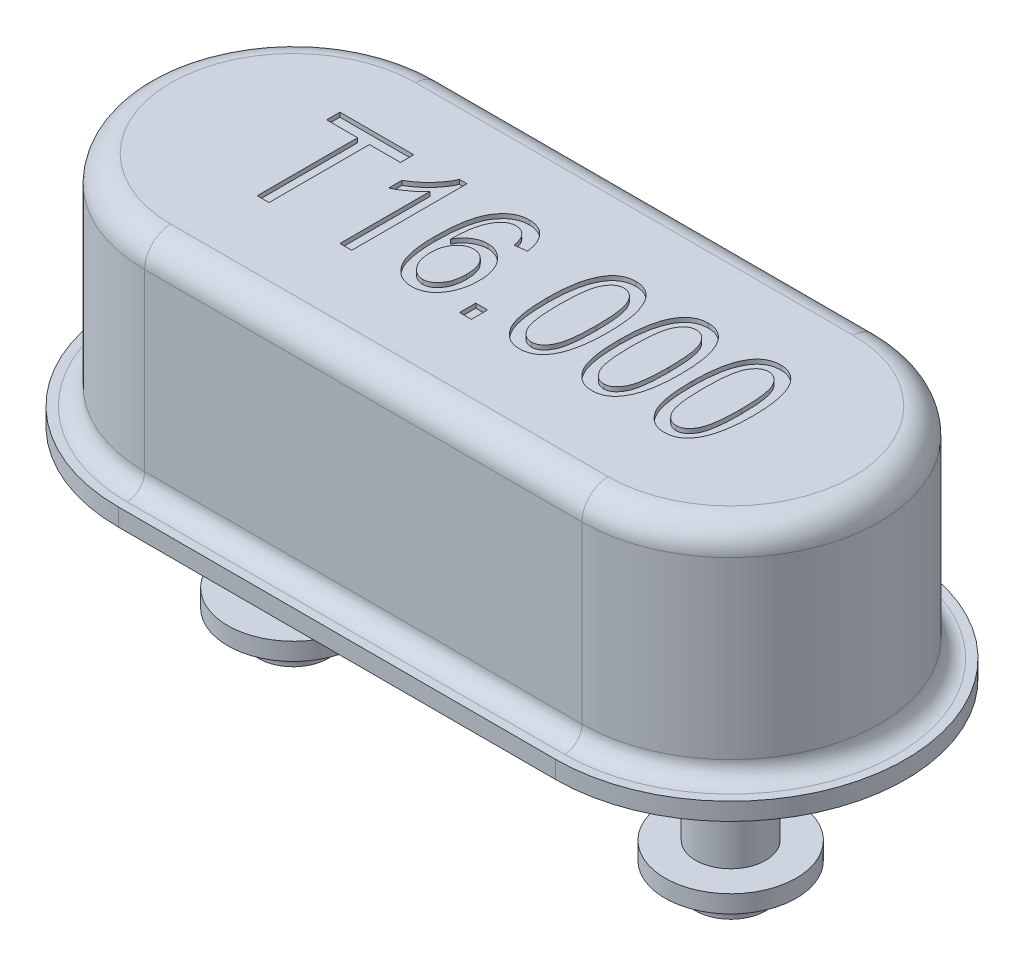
SolidWorks part; units mm, degrees
ref_plane "Plan de face" through (0, 0, 0) normal (0, 0, 1) x (1, 0, 0)
ref_plane "Plan de dessus" through (0, 0, 0) normal (0, 1, 0) x (1, 0, 0)
ref_plane "Plan de droite" through (0, 0, 0) normal (1, 0, 0) x (0, 0, -1)
sketch "Esquisse1" plane through (0, 0, 0) normal (0, 1, 0) x (1, 0, 0)
  line L0 (0, 2) -> (5, 2)
  line L1 (0, -2) -> (5, -2)
  arc A0 (0, -2) -> (0, 2) centre (0, 0) cw
  arc A1 (5, -2) -> (5, 2) centre (5, 0) ccw
  dimension "D1" = 2
  dimension "D2" = 5
extrude "Boss.-Extru.1" add sketch "Esquisse1" along normal blind 0.2
sketch "Esquisse2" plane through (0, 0.2, 0) normal (0, 1, 0) x (1, 0, 0)
  line L0 (0, 1.7) -> (5, 1.7)
  line L1 (0, -1.7) -> (5, -1.7)
  arc A0 (0, -1.7) -> (0, 1.7) centre (0, 0) cw
  arc A1 (5, 1.7) -> (5, -1.7) centre (5, 0) cw
  dimension "D1" = 1.7
  dimension "D2" = 1.7
extrude "Boss.-Extru.2" add sketch "Esquisse2" along normal blind 2.5
sketch "Esquisse3" plane through (0, 0, 0) normal (0, -1, 0) x (1, 0, 0)
  circle A0 centre (0, 0) radius 0.4
  circle A1 centre (5, 0) radius 0.4
  dimension "D1" = 0.8
extrude "Boss.-Extru.3" add sketch "Esquisse3" along normal blind 1.6
sketch "Esquisse4" plane through (0, -1.6, 0) normal (0, -1, 0) x (1, 0, 0)
  circle A0 centre (0, 0) radius 0.75
  circle A1 centre (5, 0) radius 0.75
  dimension "D1" = 1.5
extrude "Boss.-Extru.4" add sketch "Esquisse4" along normal blind 0.2
sketch "Esquisse5" plane through (0, -1.8, 0) normal (0, -1, 0) x (1, 0, 0)
  circle A0 centre (0, 0) radius 0.4
  circle A1 centre (5, 0) radius 0.4
  dimension "D1" = 0.8
extrude "Boss.-Extru.5" add sketch "Esquisse5" along normal blind 0.3
fillet "Congé1" radius 0.3 2 edges at (5, -1.8, -0.4) (0, -1.8, -0.4)
fillet "Congé3" radius 0.2 4 edges at (2.5, 0.2, -1.7) (6.7, 0.2, 0) (2.5, 0.2, 1.7) (-1.7, 0.2, 0)
fillet "Congé4" radius 0.3 4 edges at (2.5, 2.7, -1.7) (6.7, 2.7, 0) (2.5, 2.7, 1.7) (-1.7, 2.7, 0)
sketch "Esquisse6" plane through (0, 2.7, 0) normal (0, 1, 0) x (1, 0, 0)
  line L0 (-0.1762, -0.625) -> (5.5136, -0.625) construction
  text T0 "T16.000" font "Arial Narrow" height 1.3
extrude "Enlèv. mat.-Extru.1" cut sketch "Esquisse6" against normal blind 0.05
